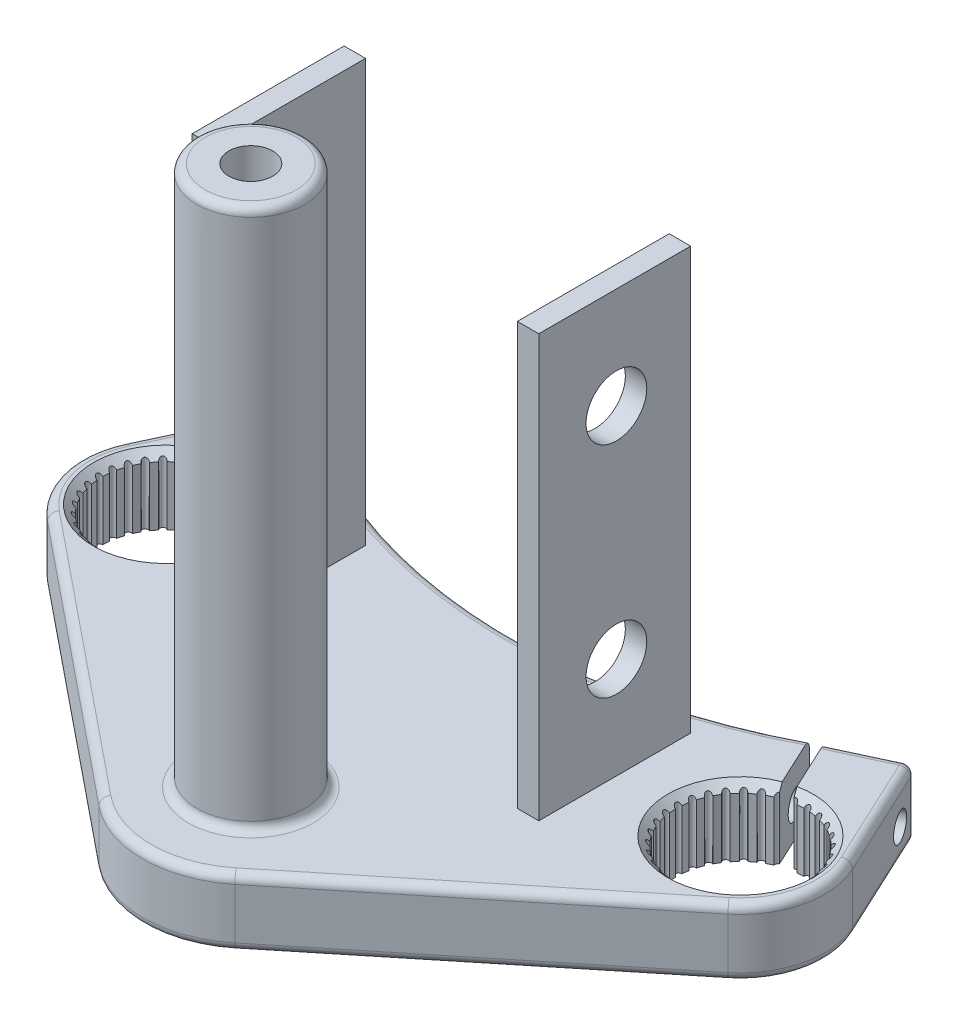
SolidWorks part; units mm, degrees
ref_plane "Front Plane" through (0, 0, 0) normal (0, 0, 1) x (1, 0, 0)
ref_plane "Top Plane" through (0, 0, 0) normal (0, 1, 0) x (1, 0, 0)
ref_plane "Right Plane" through (0, 0, 0) normal (1, 0, 0) x (0, 0, -1)
sketch "Sketch1" plane through (0, 0, 0) normal (0, 1, 0) x (1, 0, 0)
  line L0 (0, 0) -> (0, 291.318) construction
  line L11 (20.1559, -24.8544) -> (100.8468, 40.5825)
  line L12 (73.572, 96.5528) -> (81.8848, 78.726)
  line L13 (73.572, 96.5528) -> (91.6982, 105.0052)
  line L14 (91.6982, 105.0052) -> (107.7577, 70.5655)
  line L15 (70.3357, 95.2115) -> (78.4548, 77.8)
  line L16 (-70.3357, 95.2115) -> (-78.4548, 77.8)
  line L17 (-91.6982, 105.0052) -> (-107.7577, 70.5655)
  line L18 (-73.572, 96.5528) -> (-91.6982, 105.0052)
  line L19 (-73.572, 96.5528) -> (-81.8848, 78.726)
  line L20 (-20.1559, -24.8544) -> (-100.8468, 40.5825)
  arc A6 (-70.3357, 95.2115) -> (70.3357, 95.2115) centre (0, 229.959) ccw
  arc A7 (-20.1559, -24.8544) -> (20.1559, -24.8544) centre (0, 0) ccw
  arc A8 (100.8468, 40.5825) -> (107.7577, 70.5655) centre (85.1, 60) ccw
  arc A9 (78.4548, 77.8) -> (81.8848, 78.726) centre (85.1, 60) ccw
  arc A10 (-78.4548, 77.8) -> (-81.8848, 78.726) centre (-85.1, 60) cw
  arc A11 (-100.8468, 40.5825) -> (-107.7577, 70.5655) centre (-85.1, 60) cw
  dimension "D1" = 60
  dimension "D2" = 85.1
  dimension "D3" = 25
  dimension "D7" = 38
  dimension "D4" = 32
  dimension "D5" = 152
  dimension "D6" = 38
  dimension "D8" = 3.5
  dimension "D9" = 20
  dimension "D10" = 25
  dimension "D11" = 170.2
extrude "Boss-Extrude1" add sketch "Sketch1" along normal blind 20 contours A6 L15 A9 L12 L13 L14 A8 L11 A7 L20 A11 L17 L18 L19 A10 L16
sketch "Sketch2" plane through (0, 20, 0) normal (0, 1, 0) x (1, 0, 0)
  circle A0 centre (0, 0) radius 16
  dimension "D1" = 32
extrude "Boss-Extrude2" add sketch "Sketch2" along normal blind 160
sketch "Sketch3" plane through (0, 20, 0) normal (0, 1, 0) x (1, 0, 0)
  line L0 (0, 0) -> (0, 115.1137) construction
  line L1 (45, 34) -> (51.35, 34)
  line L2 (45, 34) -> (45, 79)
  line L3 (45, 79) -> (51.35, 79)
  line L4 (51.35, 34) -> (51.35, 79)
  line L5 (45, 34) -> (51.35, 79) construction
  line L6 (45, 79) -> (51.35, 34) construction
  line L7 (-45, 34) -> (-45, 79)
  line L8 (-45, 34) -> (-51.35, 34)
  line L9 (-51.35, 34) -> (-51.35, 79)
  line L10 (-45, 79) -> (-51.35, 79)
  arc A0 (78.4548, 77.8) -> (81.8848, 78.726) centre (85.1, 60) ccw construction
  point P0 (48.175, 56.5)
  dimension "D1" = 6.35
  dimension "D2" = 45
  dimension "D3" = 26
  dimension "D4" = 45
extrude "Boss-Extrude3" add sketch "Sketch3" along normal blind 125
other "Hole1" parameters "D1"=25
sketch "Sketch4" plane through (0, 180, 0) normal (0, 1, 0) x (1, 0, 0)
  circle A0 centre (0, 0) radius 6.5
  circle A2 centre (0, 0) radius 16 construction
  dimension "D1" = 13
sketch "Sketch5" plane through (115.5396, 0, -53.877) normal (0.9063, 0, -0.4226) x (-0.4226, 0, -0.9063)
  line L0 (56.5658, 20) -> (56.5658, 0) construction
  line L1 (75.3528, 0) -> (-75.3528, 0) construction
  circle A0 centre (47.5658, 9) radius 4
  dimension "D1" = 8
  dimension "D2" = 9
  dimension "D3" = 9
extrude "Cut-Extrude1" cut sketch "Sketch5" against normal blind 32
mirror "Mirror1" about plane through (0, 0, 0) normal (1, 0, 0) of "Cut-Extrude1"
chamfer "Chamfer1" distance 2.5 angle 45 2 edges at (-90.0519, 20, -41.6566) (90.0519, 20, -41.6566)
sketch "Sketch6" plane through (0, 20, 0) normal (0, 1, 0) x (1, 0, 0)
  circle A0 centre (78.4548, 77.8) radius 0.9
  dimension "D1" = 1.8
extrude "Cut-Extrude2" cut sketch "Sketch6" against normal through all
pattern_circular "CirPattern1" count 32 over 360 about axis through (85.1, 0, -60) along (0, 1, 0) of "Cut-Extrude2"
mirror "Mirror2" about plane through (0, 0, 0) normal (1, 0, 0) of "CirPattern1", "Cut-Extrude2"
fillet "Fillet1" radius 2.5 24 edges at (99.7279, 20, -87.7853) (109.4612, 20, -54.3849) (60.5013, 20, -7.8641) (0, 20, 32) (-60.5013, 20, -7.8641) (-109.4612, 20, -54.3849) (99.7279, 0, -87.7853) (109.4612, 0, -54.3849) (60.5013, 0, -7.8641) (0, 0, 32) (-60.5013, 0, -7.8641) (-109.4612, 0, -54.3849) (0, 180, 16) (0, 20, -16) (-99.7279, 20, -87.7853) (-99.7279, 0, -87.7853) (-91.6982, 10, -105.0052) (-82.6351, 20, -100.779) (-82.6351, 0, -100.779) (0, 20, -77.959) (0, 0, -77.959) (91.6982, 10, -105.0052) (82.6351, 0, -100.779) (82.6351, 20, -100.779)
sketch "Sketch7" plane through (51.35, 0, 0) normal (1, 0, 0) x (0, 0, -1)
  line L0 (34, 145) -> (79, 145) construction
  line L2 (79, 145) -> (79, 20) construction
  line L3 (57, 115) -> (57, 50) construction
  circle A0 centre (57, 115) radius 9
  circle A1 centre (57, 50) radius 9
  dimension "D1" = 18
  dimension "D2" = 18
  dimension "D3" = 30
  dimension "D4" = 65
  dimension "D5" = 22
extrude "Cut-Extrude3" cut sketch "Sketch7" against normal through all
